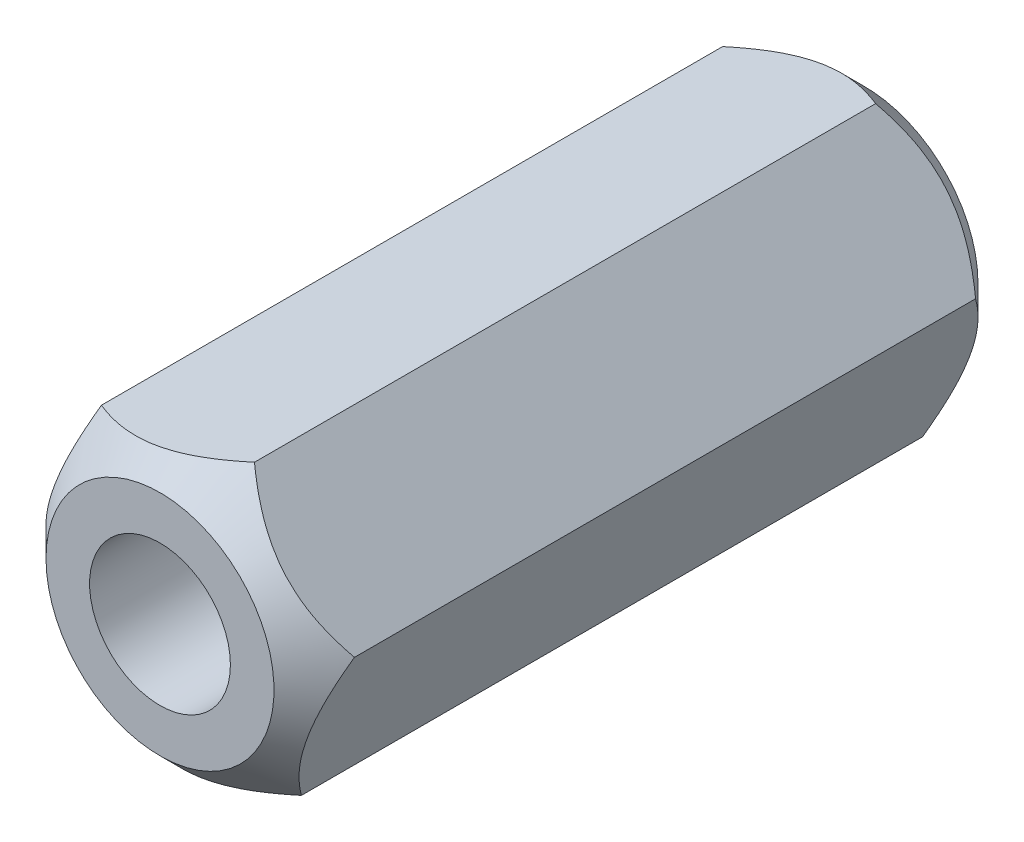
SolidWorks part; units mm, degrees
ref_plane "Face" through (0, 0, 0) normal (0, 0, 1) x (1, 0, 0)
ref_plane "Dessus" through (0, 0, 0) normal (0, 1, 0) x (1, 0, 0)
ref_plane "Droite" through (0, 0, 0) normal (1, 0, 0) x (0, 0, -1)
imported_body "Importée1"
sketch "Esquisse1" plane through (0, 0, 17) normal (0, 0, 1) x (1, 0, 0)
  circle A0 centre (17.14, 214.32) radius 5.5056 construction
  circle A1 centre (17.14, 214.32) radius 5.5056
extrude "Extrusion1" add sketch "Esquisse1" against normal through all
hole_wizard "Trou taraudé M8x1.251" positions "Esquisse3" profile "Esquisse2" tap size "M8x1.25" standard "ISO"
sketch "Esquisse3" plane through (0, 0, 17) normal (0, 0, 1) x (1, 0, 0)
  circle A0 centre (17.14, 214.32) radius 5.5056 construction
  point P0 (17.14, 214.32)
sketch "Esquisse2" plane through (17.14, 214.32, 17) normal (1, 0, 0) x (0, -1, 0)
  line L0 (0, 0) -> (0, 34)
  line L1 (0, 34) -> (3.4, 34)
  line L2 (3.4, 34) -> (3.4, 0)
  line L5 (3.4, 0) -> (0, 0)
  line L11 (0, -6.35) -> (0, 107.95) construction
  dimension "Diamètre du trou pour taraudage jusqu'au prochain" = 6.8
  dimension "Profondeur du trou pour taraudage jusqu'au prochain" = 34
